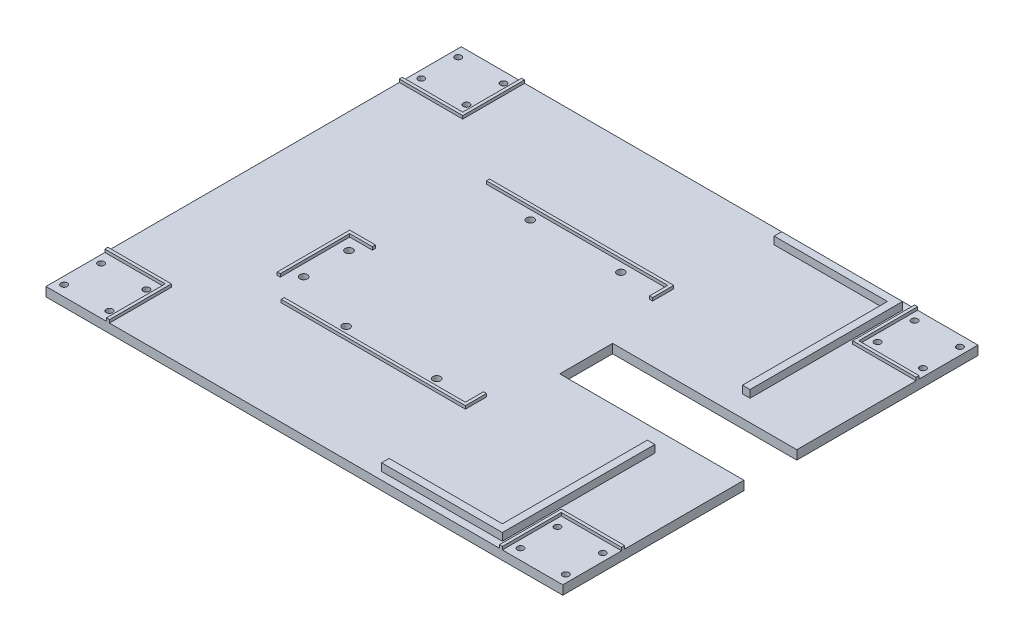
SolidWorks part; units mm, degrees
ref_plane "Front Plane" through (0, 0, 0) normal (0, 0, 1) x (1, 0, 0)
ref_plane "Top Plane" through (0, 0, 0) normal (0, 1, 0) x (1, 0, 0)
ref_plane "Right Plane" through (0, 0, 0) normal (1, 0, 0) x (0, 0, -1)
sketch "Sketch2" plane through (0, 0, 0) normal (0, 1, 0) x (1, 0, 0)
  line L1 (-170, -137.5) -> (170, -137.5)
  line L2 (-170, -137.5) -> (-170, 137.5)
  line L3 (-170, 137.5) -> (170, 137.5)
  line L4 (170, -137.5) -> (170, 137.5)
  line L5 (-170, -137.5) -> (170, 137.5) construction
  line L6 (-170, 137.5) -> (170, -137.5) construction
  line L11 (-166.12, 130.5) -> (-136.12, 130.5)
  line L12 (-166.12, 130.5) -> (-166.12, 106)
  line L13 (-166.12, 106) -> (-136.12, 106)
  line L14 (-136.12, 130.5) -> (-136.12, 106)
  line L15 (-166.12, 130.5) -> (-136.12, 106) construction
  line L16 (-166.12, 106) -> (-136.12, 130.5) construction
  line L17 (166.12, -106) -> (136.12, -106)
  line L18 (166.12, -106) -> (166.12, -130.5)
  line L19 (166.12, -130.5) -> (136.12, -130.5)
  line L20 (136.12, -106) -> (136.12, -130.5)
  line L21 (166.12, -106) -> (136.12, -130.5) construction
  line L22 (166.12, -130.5) -> (136.12, -106) construction
  line L23 (136.12, 130.5) -> (166.12, 130.5)
  line L24 (136.12, 130.5) -> (136.12, 106)
  line L25 (136.12, 106) -> (166.12, 106)
  line L26 (166.12, 130.5) -> (166.12, 106)
  line L27 (136.12, 130.5) -> (166.12, 106) construction
  line L28 (136.12, 106) -> (166.12, 130.5) construction
  line L29 (-166.12, -106) -> (-136.12, -106)
  line L30 (-166.12, -106) -> (-166.12, -130.5)
  line L31 (-166.12, -130.5) -> (-136.12, -130.5)
  line L32 (-136.12, -106) -> (-136.12, -130.5)
  line L33 (-166.12, -106) -> (-136.12, -130.5) construction
  line L34 (-166.12, -130.5) -> (-136.12, -106) construction
  circle A0 centre (-166.12, 130.5) radius 2.1
  circle A1 centre (-136.12, 130.5) radius 2.1
  circle A2 centre (-136.12, 106) radius 2.1
  circle A3 centre (-166.12, 106) radius 2.1
  circle A4 centre (166.12, -130.5) radius 2.1
  circle A5 centre (166.12, -106) radius 2.1
  circle A6 centre (136.12, -106) radius 2.1
  circle A7 centre (136.12, -130.5) radius 2.1
  circle A8 centre (-136.12, -130.5) radius 2.1
  circle A9 centre (-136.12, -106) radius 2.1
  circle A10 centre (-166.12, -130.5) radius 2.1
  circle A11 centre (-166.12, -106) radius 2.1
  circle A12 centre (166.12, 106) radius 2.1
  circle A13 centre (166.12, 130.5) radius 2.1
  circle A14 centre (136.12, 130.5) radius 2.1
  circle A15 centre (136.12, 106) radius 2.1
  point P0 (0, 0)
  point P6 (-151.12, 118.25)
  point P11 (151.12, -118.25)
  point P16 (151.12, 118.25)
  point P21 (-151.12, -118.25)
  dimension "D19" = 4.2
  dimension "D20" = 4.2
  dimension "D21" = 4.2
  dimension "D22" = 4.2
  dimension "D23" = 4.2
  dimension "D24" = 4.2
  dimension "D25" = 4.2
  dimension "D26" = 4.2
  dimension "D27" = 4.2
  dimension "D28" = 4.2
  dimension "D29" = 4.2
  dimension "D30" = 4.2
  dimension "D31" = 4.2
  dimension "D32" = 4.2
  dimension "D33" = 4.2
  dimension "D34" = 4.2
  dimension "D1" = 340
  dimension "D2" = 275
  dimension "D3" = 30
  dimension "D4" = 24.5
  dimension "D5" = 3.88
  dimension "D6" = 7
  dimension "D7" = 3.88
  dimension "D8" = 7
  dimension "D9" = 30
  dimension "D10" = 24.5
  dimension "D11" = 7
  dimension "D12" = 3.88
  dimension "D13" = 30
  dimension "D14" = 24.5
  dimension "D15" = 7
  dimension "D16" = 3.88
  dimension "D17" = 30
  dimension "D18" = 24.5
extrude "Boss-Extrude1" add sketch "Sketch2" along normal blind 6 contours L1 L4 L3 L2 A15 L24 A14 L23 A13 L26 A12 L25 A11 L29 A9 L32 A8 L31 A10 L30 A7 L20 A6 L17 A5 L18 A4 L19 A3 L12 A0 L11 A1 L14 A2 L13 | A11 L30 A10 L31 A8 L32 A9 L29 | A3 L13 A2 L14 A1 L11 A0 L12 | A15 L25 A12 L26 A13 L23 A14 L24 | A7 L19 A4 L18 A5 L17 A6 L20
sketch "Sketch5" plane through (0, 6, 0) normal (0, 1, 0) x (1, 0, 0)
  line L0 (-170, -137.5) -> (-170, 137.5) construction
  line L1 (171.12, -137.5) -> (-171.12, -137.5)
  line L2 (171.12, -137.5) -> (171.12, 137.5)
  line L3 (171.12, 137.5) -> (-171.12, 137.5)
  line L4 (-171.12, -137.5) -> (-171.12, 137.5)
  line L5 (171.12, -137.5) -> (-171.12, 137.5) construction
  line L6 (171.12, 137.5) -> (-171.12, -137.5) construction
  line L7 (168.7827, -137.5) -> (-168.7827, -137.5)
  line L8 (168.7827, -137.5) -> (168.7827, 137.5)
  line L9 (168.7827, 137.5) -> (-168.7827, 137.5)
  line L10 (-168.7827, -137.5) -> (-168.7827, 137.5)
  line L11 (168.7827, -137.5) -> (-168.7827, 137.5) construction
  line L12 (168.7827, 137.5) -> (-168.7827, -137.5) construction
  line L14 (-170, 137.5) -> (170, 137.5) construction
  point P0 (0, 0)
  point P6 (0, 0)
  dimension "D1" = 1.12
extrude "Boss-Extrude3" add sketch "Sketch5" against normal blind 6 contours L8 M18 M19 M20 | L2 L3 L1 M19 | L10 M18 M20 M21 | L4 L1 L3 M21
sketch "Sketch7" plane through (0, 6, 0) normal (0, 1, 0) x (1, 0, 0)
  line L0 (171.12, -137.5) -> (171.12, 137.5) construction
  line L1 (71.12, 50) -> (271.12, 50)
  line L2 (71.12, 50) -> (71.12, -50)
  line L3 (71.12, -50) -> (271.12, -50)
  line L4 (271.12, 50) -> (271.12, -50)
  line L5 (71.12, 50) -> (271.12, -50) construction
  line L6 (71.12, -50) -> (271.12, 50) construction
  point P0 (171.12, 0)
  dimension "D1" = 100
  dimension "D2" = 200
extrude "Cut-Extrude1" cut sketch "Sketch7" against normal blind 10
sketch "Sketch8" plane through (0, 6, 0) normal (0, 1, 0) x (1, 0, 0)
  line L0 (71.12, -50) -> (171.12, -50) construction
  line L1 (171.12, 50) -> (71.12, 50) construction
  line L2 (171.12, 50) -> (171.12, 137.5) construction
  line L3 (171.12, -137.5) -> (171.12, -50) construction
  circle A0 centre (11.12, 61) radius 2.5
  circle A1 centre (-48.88, 61) radius 2.5
  circle A2 centre (11.12, -61) radius 2.5
  circle A3 centre (-48.88, -61) radius 2.5
  dimension "D1" = 5
  dimension "D2" = 5
  dimension "D3" = 5
  dimension "D4" = 5
  dimension "D5" = 11
  dimension "D6" = 11
  dimension "D7" = 11
  dimension "D8" = 11
  dimension "D9" = 60
  dimension "D10" = 220
  dimension "D11" = 60
  dimension "D12" = 220
extrude "Cut-Extrude2" cut sketch "Sketch8" against normal blind 7
sketch "Sketch9" plane through (0, 6, 0) normal (0, 1, 0) x (1, 0, 0)
  line L0 (-91.38, -16.6) -> (-91.38, -46.6)
  line L1 (171.12, -137.5) -> (171.12, -50) construction
  line L2 (-171.12, -137.5) -> (171.12, -137.5) construction
  circle A0 centre (-91.38, -46.6) radius 2.5
  circle A1 centre (-91.38, -16.6) radius 2.5
  dimension "D4" = 5
  dimension "D5" = 5
  dimension "D1" = 30
  dimension "D2" = 262.5
  dimension "D3" = 90.9
extrude "Cut-Extrude3" cut sketch "Sketch9" against normal blind 10 contours A0 | A1
sketch "Sketch10" plane through (0, 6, 0) normal (0, 1, 0) x (1, 0, 0)
  line L0 (171.12, 50) -> (49.12, 50)
  line L1 (49.12, 50) -> (49.12, 17.5)
  line L2 (49.12, 17.5) -> (171.12, 17.5)
  line L3 (171.12, 17.5) -> (171.12, 50)
  line L4 (171.12, -17.5) -> (49.12, -17.5)
  line L5 (49.12, -17.5) -> (49.12, -50)
  line L6 (49.12, -50) -> (171.12, -50)
  line L7 (171.12, -50) -> (171.12, -17.5)
  dimension "D1" = 122
  dimension "D2" = 122
  dimension "D3" = 32.5
  dimension "D4" = 32.5
extrude "Boss-Extrude4" add sketch "Sketch10" against normal blind 6
sketch "Sketch11" plane through (0, 6, 0) normal (0, 1, 0) x (1, 0, 0)
  line L0 (171.12, 17.5) -> (49.12, 17.5)
  line L1 (49.12, 17.5) -> (49.12, -17.5)
  line L2 (49.12, -17.5) -> (171.12, -17.5)
  line L3 (171.12, -17.5) -> (171.12, 17.5)
  dimension "D1" = 122
extrude "Cut-Extrude4" cut sketch "Sketch11" against normal blind 6
sketch "Sketch12" plane through (0, 6, 0) normal (0, 1, 0) x (1, 0, 0)
  line L0 (46.12, -132.5) -> (126.12, -132.5)
  line L1 (126.12, -132.5) -> (126.12, -31.5)
  line L2 (126.12, -31.5) -> (121.12, -31.5)
  line L3 (121.12, -31.5) -> (121.12, -127.5)
  line L4 (121.12, -127.5) -> (46.12, -127.5)
  line L5 (46.12, -127.5) -> (46.12, -132.5)
  line L6 (-171.12, -137.5) -> (171.12, -137.5) construction
  line L7 (171.12, -137.5) -> (171.12, -17.5) construction
  line L8 (-199.1951, 0) -> (279.4725, 0)
  line L9 (46.12, 127.5) -> (46.12, 132.5)
  line L10 (121.12, 127.5) -> (46.12, 127.5)
  line L11 (46.12, 132.5) -> (126.12, 132.5)
  line L12 (121.12, 31.5) -> (121.12, 127.5)
  line L13 (126.12, 31.5) -> (121.12, 31.5)
  line L14 (126.12, 132.5) -> (126.12, 31.5)
  dimension "D1" = 101
  dimension "D2" = 80
  dimension "D3" = 5
  dimension "D4" = 5
  dimension "D5" = 5
  dimension "D6" = 45
extrude "Boss-Extrude5" add sketch "Sketch12" along normal blind 5 contours L4 L5 L0 L1 L2 L3 | L14 L11 L9 L10 L12 L13
sketch "Sketch14" plane through (0, 6, 0) normal (0, 1, 0) x (1, 0, 0)
  line L0 (-98.88, -8.6) -> (-98.88, -54.6)
  line L3 (-83.88, -8.6) -> (-98.88, -8.6)
  line L4 (-83.88, -8.6) -> (-83.88, -6.6)
  line L5 (-83.88, -6.6) -> (-100.88, -6.6)
  line L6 (-100.88, -6.6) -> (-100.88, -54.6)
  line L7 (-100.88, -54.6) -> (-98.88, -54.6)
  circle A0 centre (-91.38, -16.6) radius 2.5 construction
  point P6 (-91.38, -8.6)
  dimension "D1" = 8
  dimension "D5" = 2
  dimension "D3" = 15
  dimension "D4" = 46
  dimension "D6" = 2
extrude "Boss-Extrude6" add sketch "Sketch14" along normal blind 2
sketch "Sketch15" plane through (0, 6, 0) normal (0, 1, 0) x (1, 0, 0)
  line L0 (-131.12, 137.5) -> (-131.12, 98.5)
  line L1 (-171.12, 137.5) -> (171.12, 137.5) construction
  line L2 (-131.12, 98.5) -> (-171.12, 98.5)
  line L3 (-171.12, -137.5) -> (-171.12, 137.5) construction
  line L4 (-131.12, 137.5) -> (-129.12, 137.5)
  line L5 (-129.12, 137.5) -> (-129.12, 96.5)
  line L6 (-129.12, 96.5) -> (-171.12, 96.5)
  line L7 (-171.12, 96.5) -> (-171.12, 98.5)
  line L8 (-171.12, -98.5) -> (-131.12, -98.5)
  line L9 (-131.12, -98.5) -> (-131.12, -137.5)
  line L10 (-171.12, -137.5) -> (171.12, -137.5) construction
  line L11 (-131.12, -137.5) -> (-129.12, -137.5)
  line L12 (-129.12, -137.5) -> (-129.12, -96.5)
  line L13 (-129.12, -96.5) -> (-171.12, -96.5)
  line L14 (-171.12, -96.5) -> (-171.12, -98.5)
  line L19 (131.12, 98.5) -> (131.12, 137.5)
  line L22 (131.12, -137.5) -> (131.12, -98.5)
  line L23 (131.12, -98.5) -> (171.12, -98.5)
  line L24 (171.12, -137.5) -> (171.12, -17.5) construction
  line L25 (131.12, -137.5) -> (129.12, -137.5)
  line L26 (129.12, -137.5) -> (129.12, -96.5)
  line L27 (129.12, -96.5) -> (171.12, -96.5)
  line L28 (171.12, -96.5) -> (171.12, -98.5)
  line L29 (171.12, 98.5) -> (131.12, 98.5)
  line L30 (171.12, 17.5) -> (171.12, 137.5) construction
  line L31 (131.12, 137.5) -> (129.12, 137.5)
  line L32 (129.12, 137.5) -> (129.12, 96.5)
  line L33 (129.12, 96.5) -> (171.12, 96.5)
  line L34 (171.12, 96.5) -> (171.12, 98.5)
  dimension "D1" = 40
  dimension "D2" = 39
  dimension "D3" = 2
  dimension "D4" = 2
  dimension "D5" = 40
  dimension "D6" = 39
  dimension "D7" = 2
  dimension "D8" = 2
  dimension "D9" = 40
  dimension "D10" = 39
  dimension "D11" = 2
  dimension "D12" = 2
  dimension "D13" = 40
  dimension "D14" = 39
  dimension "D15" = 2
  dimension "D16" = 2
extrude "Boss-Extrude7" add sketch "Sketch15" along normal blind 2
sketch "Sketch16" plane through (0, 6, 0) normal (0, 1, 0) x (1, 0, 0)
  line L0 (-83.88, 67) -> (36.12, 67)
  line L1 (36.12, 67) -> (36.12, 55)
  line L2 (-129.12, 137.5) -> (129.12, 137.5) construction
  line L3 (171.12, 17.5) -> (171.12, 96.5) construction
  line L4 (-83.88, 67) -> (-83.88, 69)
  line L5 (-83.88, 69) -> (38.12, 69)
  line L6 (38.12, 69) -> (38.12, 55)
  line L7 (38.12, 55) -> (36.12, 55)
  line L8 (-83.88, -67) -> (36.12, -67)
  line L9 (36.12, -67) -> (36.12, -55)
  line L10 (-129.12, -137.5) -> (129.12, -137.5) construction
  line L11 (171.12, -96.5) -> (171.12, -17.5) construction
  line L12 (-83.88, -67) -> (-83.88, -69)
  line L13 (-83.88, -69) -> (38.12, -69)
  line L14 (38.12, -69) -> (38.12, -55)
  line L15 (38.12, -55) -> (36.12, -55)
  point P7 (36.12, 61)
  dimension "D1" = 120
  dimension "D2" = 12
  dimension "D3" = 70.5
  dimension "D4" = 135
  dimension "D5" = 2
  dimension "D6" = 2
  dimension "D7" = 120
  dimension "D8" = 12
  dimension "D9" = 70.5
  dimension "D10" = 135
  dimension "D11" = 2
  dimension "D12" = 2
extrude "Boss-Extrude8" add sketch "Sketch16" along normal blind 2
